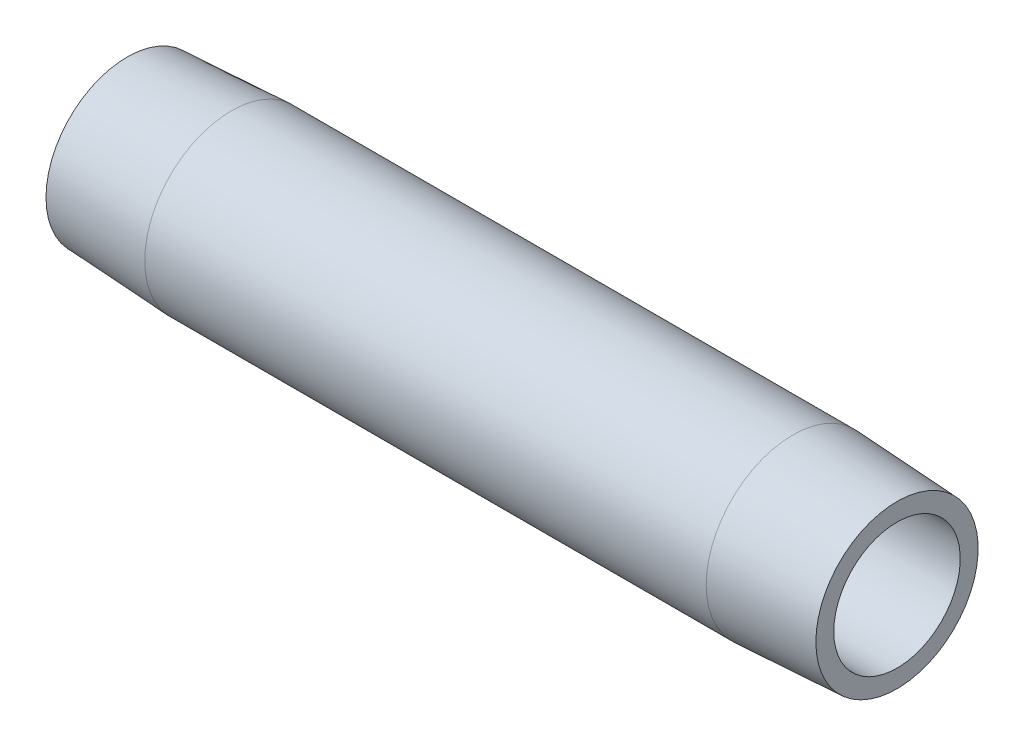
SolidWorks part; units mm, degrees
ref_plane "Front Plane" through (0, 0, 0) normal (0, 0, 1) x (1, 0, 0)
ref_plane "Top Plane" through (0, 0, 0) normal (0, 1, 0) x (1, 0, 0)
ref_plane "Right Plane" through (0, 0, 0) normal (1, 0, 0) x (0, 0, -1)
sketch "Sketch1" plane through (0, 0, 0) normal (0, 0, 1) x (1, 0, 0)
  line L5 (76.2, 6.2611) -> (0, 6.2611)
  line L6 (65.8876, 8.5725) -> (10.3124, 8.5725)
  line L7 (10.3124, 8.5725) -> (0, 8.0321)
  line L8 (76.2, 8.0321) -> (65.8876, 8.5725)
  line L9 (76.2, 6.2611) -> (76.2, 8.0321)
  line L10 (0, 6.2611) -> (0, 8.0321)
  line L11 (0, 0) -> (50000, 0) construction
  line L12 (0, -55) -> (0, 55) construction
  dimension "D1" = 12.5222
  dimension "D2" = 17.145
  dimension "D3" = 3
  dimension "D4" = 3
  dimension "D5" = 76.2
  dimension "D6" = 10.3124
  dimension "D7" = 10.3124
revolve "Revolve1" add sketch "Sketch1" angle 360 about L11
